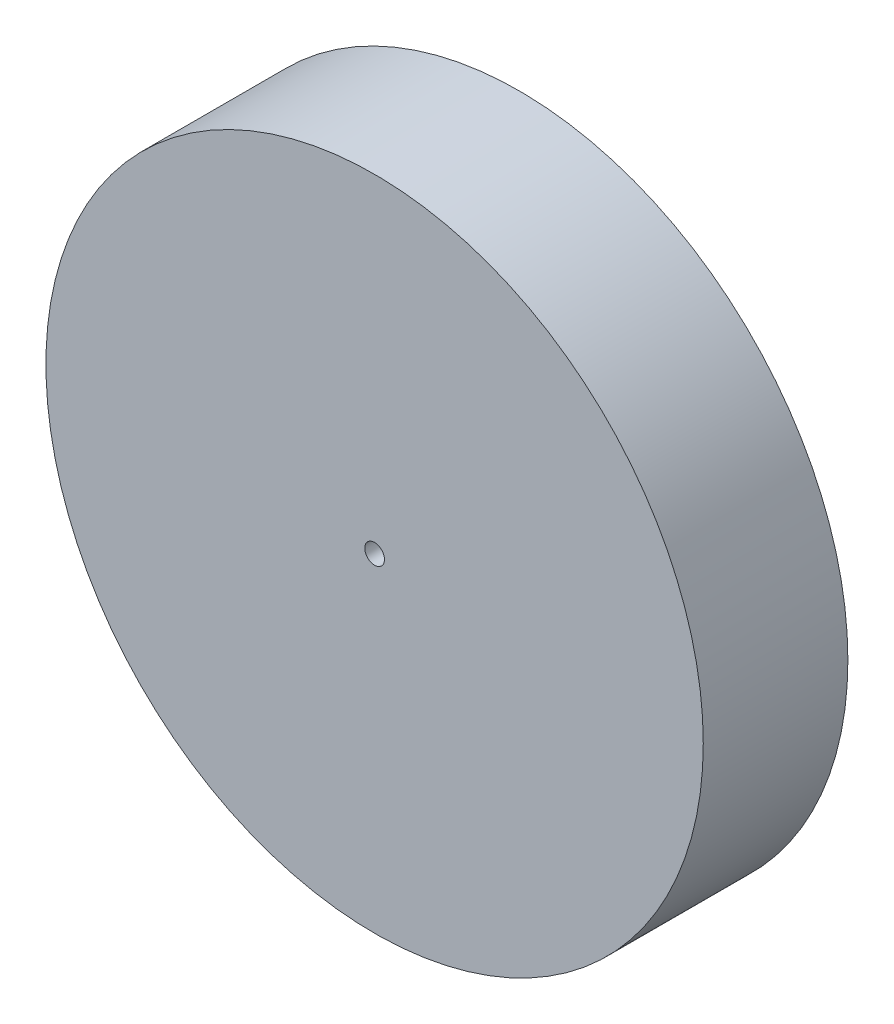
SolidWorks part; units mm, degrees
ref_plane "Front Plane" through (0, 0, 0) normal (0, 0, 1) x (1, 0, 0)
ref_plane "Top Plane" through (0, 0, 0) normal (0, 1, 0) x (1, 0, 0)
ref_plane "Right Plane" through (0, 0, 0) normal (1, 0, 0) x (0, 0, -1)
sketch "Sketch1" plane through (0, 0, 0) normal (0, 0, 1) x (1, 0, 0)
  circle A0 centre (0, 0) radius 50.8
  dimension "D1" = 101.6
extrude "Boss-Extrude1" add sketch "Sketch1" along normal blind 22.352 contours A0
sketch "Sketch2" plane through (0, 0, 22.352) normal (0, 0, 1) x (1, 0, 0)
  circle A0 centre (0, 0) radius 1.524
  dimension "D1" = 3.048
extrude "Cut-Extrude1" cut sketch "Sketch2" against normal blind 22.352
